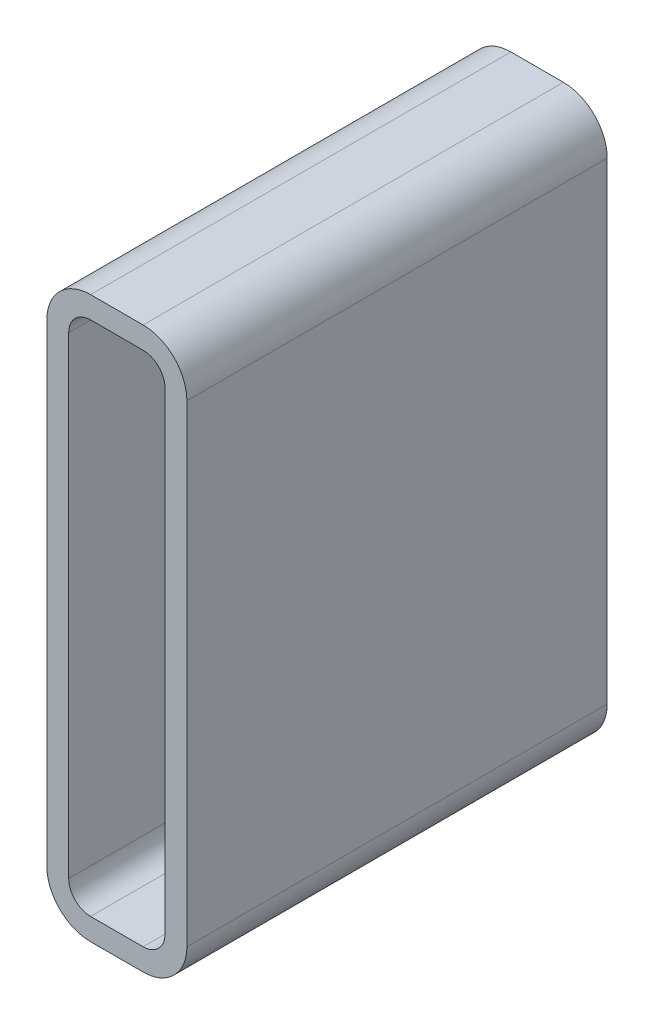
SolidWorks part; units mm, degrees
ref_plane "Front Plane" through (0, 0, 0) normal (0, 0, 1) x (1, 0, 0)
ref_plane "Top Plane" through (0, 0, 0) normal (0, 1, 0) x (1, 0, 0)
ref_plane "Right Plane" through (0, 0, 0) normal (1, 0, 0) x (0, 0, -1)
sketch "Sketch1" plane through (0, 0, 0) normal (0, 0, 1) x (1, 0, 0)
sketch_block_instance "HSS16x4x0.625-1"
sketch_block "HSS16x4x0.625"
extrude "Boss-Extrude1" add sketch "Sketch1" along normal blind 304.8
